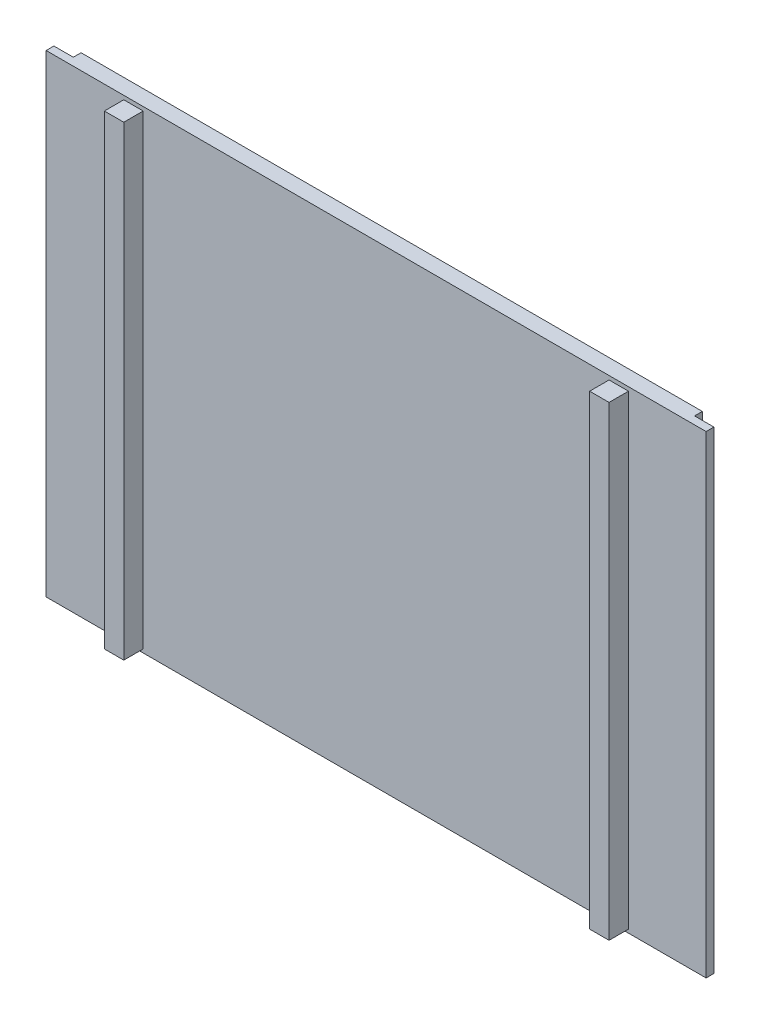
SolidWorks part; units mm, degrees
ref_plane "Alzado" through (0, 0, 0) normal (0, 0, 1) x (1, 0, 0)
ref_plane "Planta" through (0, 0, 0) normal (0, 1, 0) x (1, 0, 0)
ref_plane "Vista lateral" through (0, 0, 0) normal (1, 0, 0) x (0, 0, -1)
sketch "Croquis1" plane through (0, 0, 0) normal (0, 0, 1) x (1, 0, 0)
  line L1 (0, 0) -> (850, 0)
  line L2 (0, 0) -> (0, 609.5)
  line L3 (0, 609.5) -> (850, 609.5)
  line L4 (850, 0) -> (850, 609.5)
  dimension "D1" = 850
  dimension "D2" = 609.5
extrude "Saliente-Extruir1" add sketch "Croquis1" along normal blind 10
sketch "Croquis2" plane through (0, 0, 0) normal (0, 0, -1) x (-1, 0, 0)
  line L1 (-825.16, 4.99) -> (-25, 4.99)
  line L2 (-825.16, 4.99) -> (-825.16, 609.5)
  line L3 (-825.16, 609.5) -> (-25, 609.5)
  line L12 (-25, 4.99) -> (-25, 609.5)
  line L13 (-820.16, 9.99) -> (-30, 9.99)
  line L14 (-820.16, 9.99) -> (-820.16, 604.5)
  line L15 (-820.16, 604.5) -> (-30, 604.5)
  line L16 (-30, 9.99) -> (-30, 604.5)
  line L17 (-850, 609.5) -> (0, 609.5) construction
  line L18 (0, 609.5) -> (0, 0) construction
  dimension "D2" = 604.51
  dimension "D3" = 5
  dimension "D4" = 5
  dimension "D5" = 5
  dimension "D1" = 800.16
  dimension "D6" = 5
  dimension "D7" = 0
  dimension "D8" = 25
extrude "Saliente-Extruir2" add sketch "Croquis2" along normal blind 10
sketch "Croquis8" plane through (0, 0, 10) normal (0, 0, 1) x (1, 0, 0)
  line L0 (850, 0) -> (850, 609.5) construction
  line L1 (100, 604.5) -> (125, 604.5)
  line L2 (100, 604.5) -> (100, 4.5)
  line L3 (100, 4.5) -> (125, 4.5)
  line L4 (125, 604.5) -> (125, 4.5)
  line L5 (725, 604.5) -> (750, 604.5)
  line L6 (725, 604.5) -> (725, 4.5)
  line L7 (725, 4.5) -> (750, 4.5)
  line L8 (750, 604.5) -> (750, 4.5)
  line L10 (850, 609.5) -> (0, 609.5) construction
  dimension "D1" = 600
  dimension "D2" = 25
  dimension "D3" = 25
  dimension "D4" = 100
  dimension "D5" = 5
  dimension "D6" = 5
  dimension "D7" = 600
  dimension "D8" = 600
extrude "Saliente-Extruir6" add sketch "Croquis8" along normal blind 25
